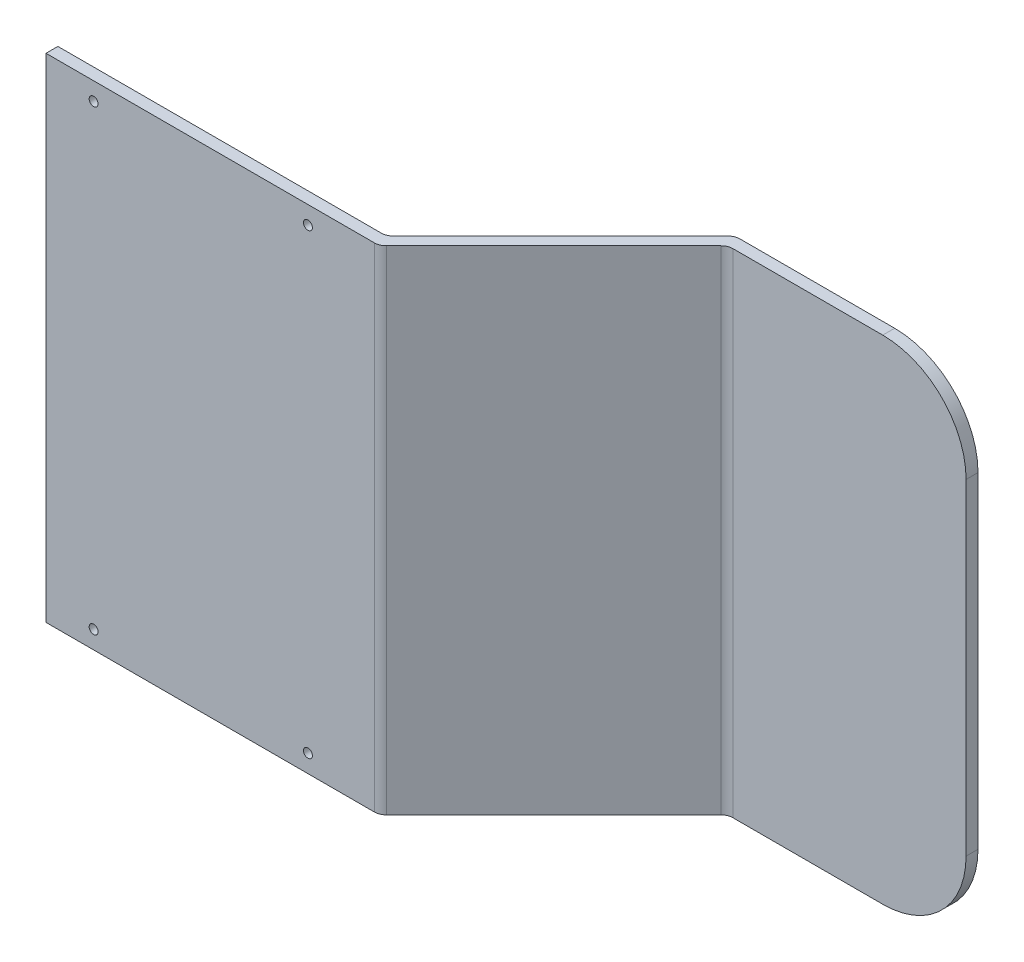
SolidWorks part; units mm, degrees
ref_plane "Front Plane" through (0, 0, 0) normal (0, 0, 1) x (1, 0, 0)
ref_plane "Top Plane" through (0, 0, 0) normal (0, 1, 0) x (1, 0, 0)
ref_plane "Right Plane" through (0, 0, 0) normal (1, 0, 0) x (0, 0, -1)
sketch "Sketch1" plane through (0, 0, 0) normal (0, 1, 0) x (1, 0, 0)
  line L0 (0, 0) -> (355.6, 0)
  line L1 (355.6, 0) -> (541.528, 185.928)
  line L2 (541.528, 185.928) -> (795.528, 185.928)
  line L3 (795.528, 185.928) -> (795.528, 198.628)
  line L4 (795.528, 198.628) -> (536.2675, 198.628)
  line L5 (536.2675, 198.628) -> (350.3395, 12.7)
  line L6 (350.3395, 12.7) -> (0, 12.7)
  line L7 (0, 0) -> (0, 12.7)
  dimension "D1" = 355.6
  dimension "D2" = 254
  dimension "D3" = 45
  dimension "D4" = 185.928
  dimension "D5" = 12.7
  dimension "D6" = 12.7
  dimension "D7" = 12.7
  dimension "D8" = 795.528
  dimension "D9" = 262.9419
extrude "Extrude1" add sketch "Sketch1" against normal blind 525.78
fillet "Fillet1" radius 12.7 4 edges at (536.2675, -262.89, -198.628) (350.3395, -262.89, -12.7) (541.528, -262.89, -185.928) (355.6, -262.89, 0)
fillet "Fillet2" radius 88.9 2 edges at (795.528, -525.78, -192.278) (795.528, 0, -192.278)
sketch "Sketch2" plane through (0, 0, 0) normal (0, 0, 1) x (1, 0, 0)
  line L0 (0, -525.78) -> (0, 0) construction
  line L1 (0, 0) -> (350.3395, 0) construction
  line L2 (0, -262.89) -> (323.3336, -262.89) construction
  circle A0 centre (50.8, -19.05) radius 4.7625
  circle A1 centre (279.4, -19.05) radius 4.7625
  circle A2 centre (279.4, -506.73) radius 4.7625
  circle A3 centre (50.8, -506.73) radius 4.7625
  dimension "D1" = 9.525
  dimension "D2" = 50.8
  dimension "D3" = 19.05
  dimension "D4" = 228.6
extrude "Extrude2" cut sketch "Sketch2" against normal through all
